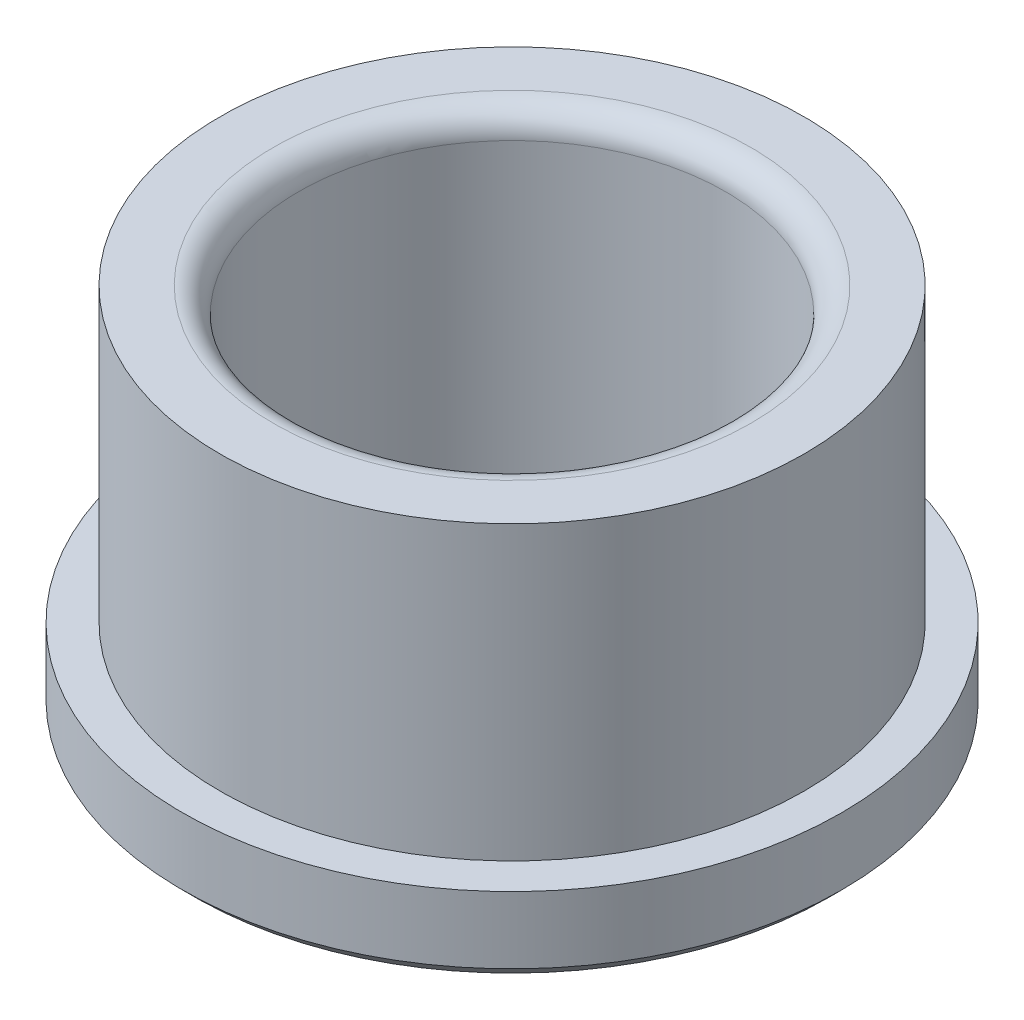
SolidWorks part; units mm, degrees
ref_plane "Front Plane" through (0, 0, 0) normal (0, 0, 1) x (1, 0, 0)
ref_plane "Top Plane" through (0, 0, 0) normal (0, 1, 0) x (1, 0, 0)
ref_plane "Right Plane" through (0, 0, 0) normal (1, 0, 0) x (0, 0, -1)
sketch "Sketch1" plane through (0, 0, 0) normal (0, 0, 1) x (1, 0, 0)
  line L0 (-18.9484, 0) -> (-19.7104, 0.762)
  line L1 (0, -1000) -> (0, 49000) construction
  line L2 (-12.7635, 22.225) -> (-12.7635, 0.762)
  line L3 (-13.5255, 0) -> (-18.9484, 0)
  line L4 (-19.7104, 0.762) -> (-19.7104, 4.7625)
  line L5 (-19.7104, 4.7625) -> (-17.4688, 4.7625)
  line L6 (-17.4688, 22.225) -> (-17.4688, 4.7625)
  line L7 (-17.4688, 22.225) -> (-12.7635, 22.225)
  line L8 (-13.5255, 0) -> (-12.7635, 0.762)
  dimension "OD" = 34.9377
  dimension "ID" = 25.527
  dimension "H" = 39.4208
  dimension "D2" = 45
  dimension "OVERALL LENGTH" = 22.225
  dimension "D4" = 0.762
  dimension "D5" = 135
  dimension "T" = 4.7625
revolve "Revolve1" add sketch "Sketch1" angle 360 about L1
fillet "Fillet1" radius 1.524 1 edges at (12.7635, 22.225, 0)
